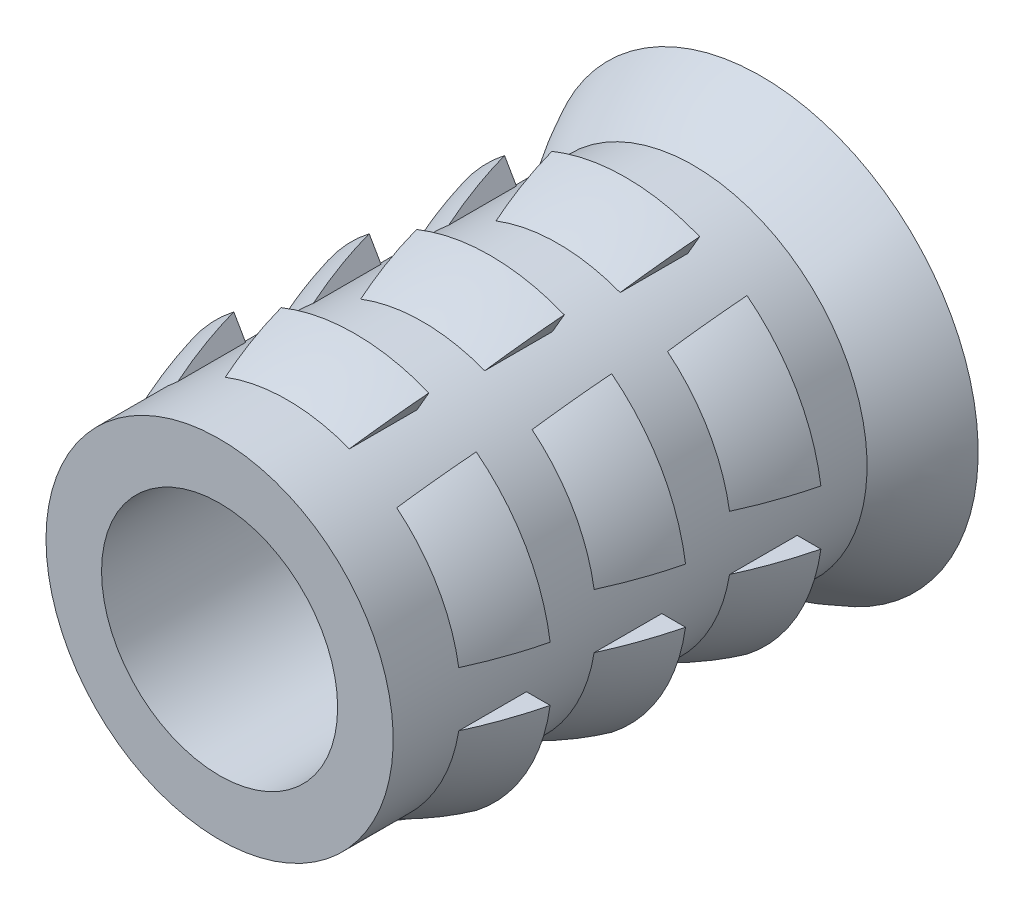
SolidWorks part; units mm, degrees
other "<insert 8-32>-<CirPattern1>"
ref_plane "Front" through (0, 0, 0) normal (0, 0, 1) x (1, 0, 0)
ref_plane "Top" through (0, 0, 0) normal (0, 1, 0) x (1, 0, 0)
ref_plane "Right" through (0, 0, 0) normal (1, 0, 0) x (0, 0, -1)
inserted part "insert 8-32"
move or copy body "Body-Move/Copy6"
